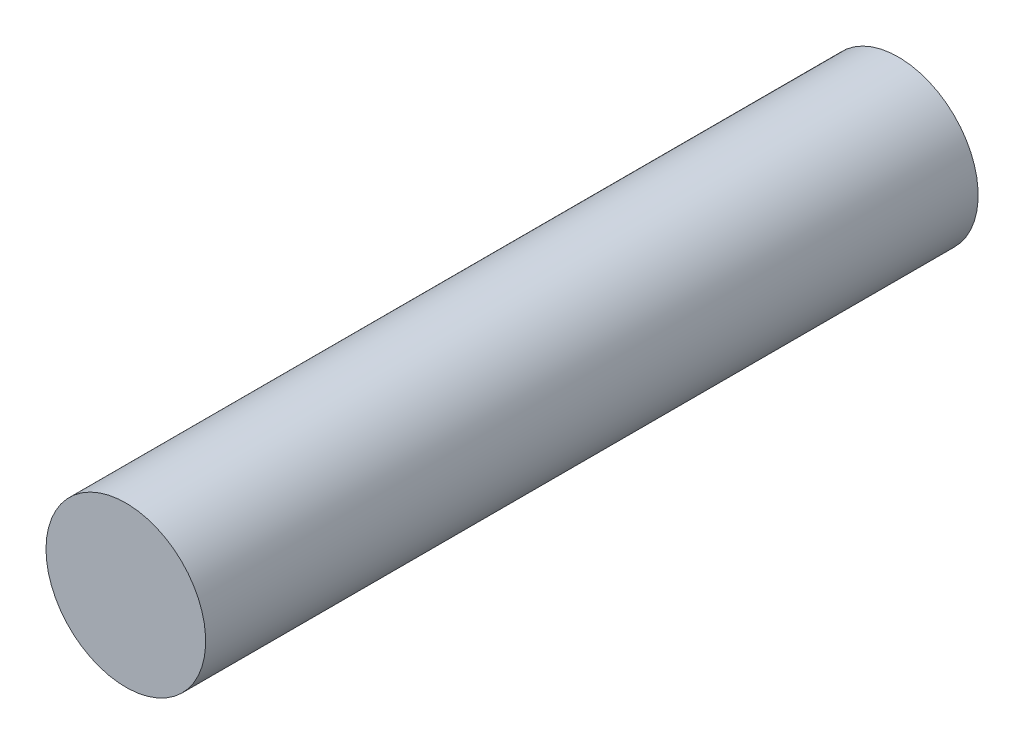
SolidWorks part; units mm, degrees
ref_plane "Front Plane" through (0, 0, 0) normal (0, 0, 1) x (1, 0, 0)
ref_plane "Top Plane" through (0, 0, 0) normal (0, 1, 0) x (1, 0, 0)
ref_plane "Right Plane" through (0, 0, 0) normal (1, 0, 0) x (0, 0, -1)
sketch "Sketch1" plane through (0, 0, 0) normal (0, 0, 1) x (1, 0, 0)
  circle A0 centre (0, 0) radius 3.937
  dimension "D1" = 7.874
extrude "Boss-Extrude1" add sketch "Sketch1" along normal blind 38.1 contours A0
